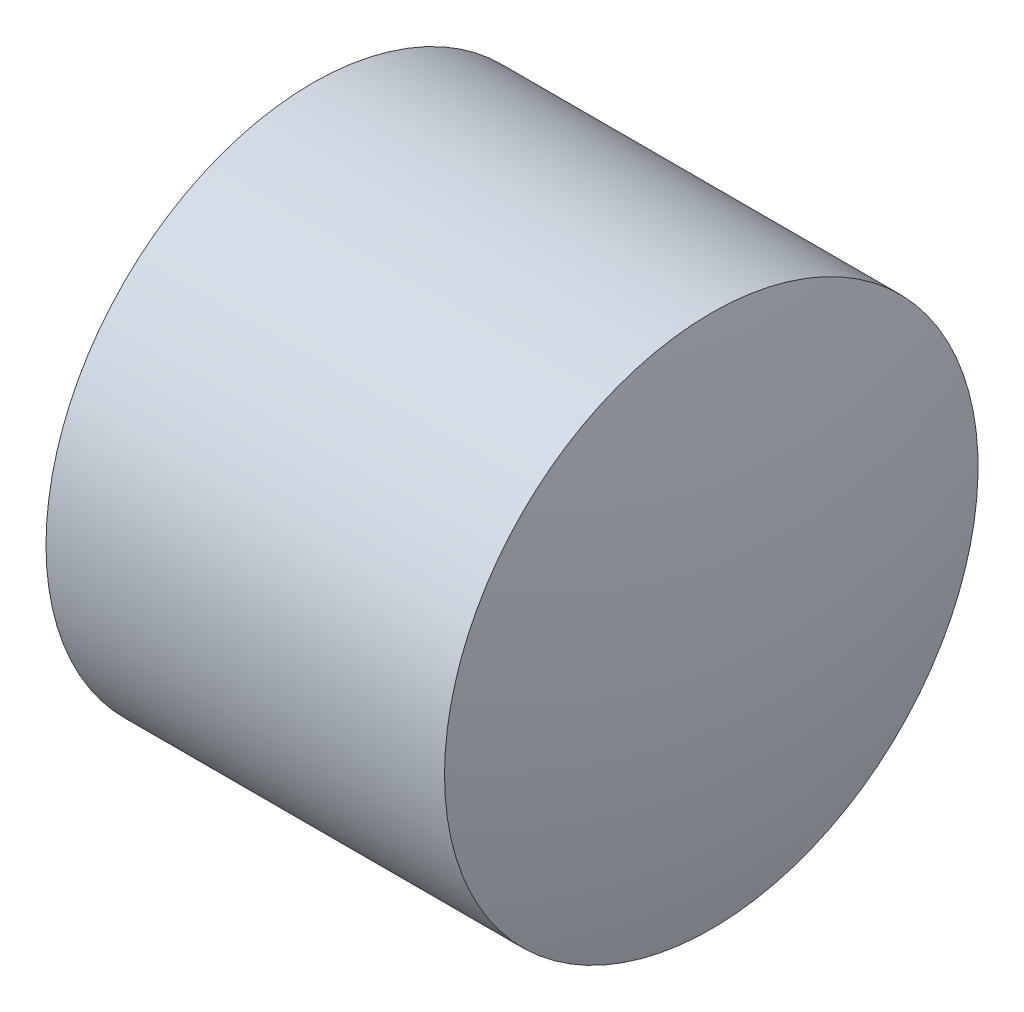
SolidWorks part; units mm, degrees
ref_plane "Vorne" through (0, 0, 0) normal (0, 0, 1) x (1, 0, 0)
ref_plane "Oben" through (0, 0, 0) normal (0, 1, 0) x (1, 0, 0)
ref_plane "Rechts" through (0, 0, 0) normal (1, 0, 0) x (0, 0, -1)
ref_plane "Ebene1" through (0, 0, 8) normal (0, 0, 1) x (1, 0, 0)
sketch "Skizze1" plane through (0, 0, 8) normal (0, 0, 1) x (1, 0, 0)
  line L0 (11.7447, 2.5) -> (23.1101, 2.5) construction
  line L1 (0, 0) -> (113.9649, 0) construction
  line L2 (19.3754, 2.5) -> (23.1101, 2.5)
  line L3 (0, 0) -> (113.9649, 0) construction
  line L4 (18.835, 0) -> (23.435, 0)
  arc A0 (19.3754, 2.5) -> (18.835, 0) centre (24.8875, 0) ccw construction
  arc A1 (23.435, 0) -> (23.1101, 2.5) centre (13.654, 0) ccw construction
  arc A2 (19.3754, 2.5) -> (18.835, 0) centre (24.8875, 0) ccw
  arc A3 (23.435, 0) -> (23.1101, 2.5) centre (13.654, 0) ccw
revolve "Rotation1" add sketch "Skizze1" angle 360 about L3
